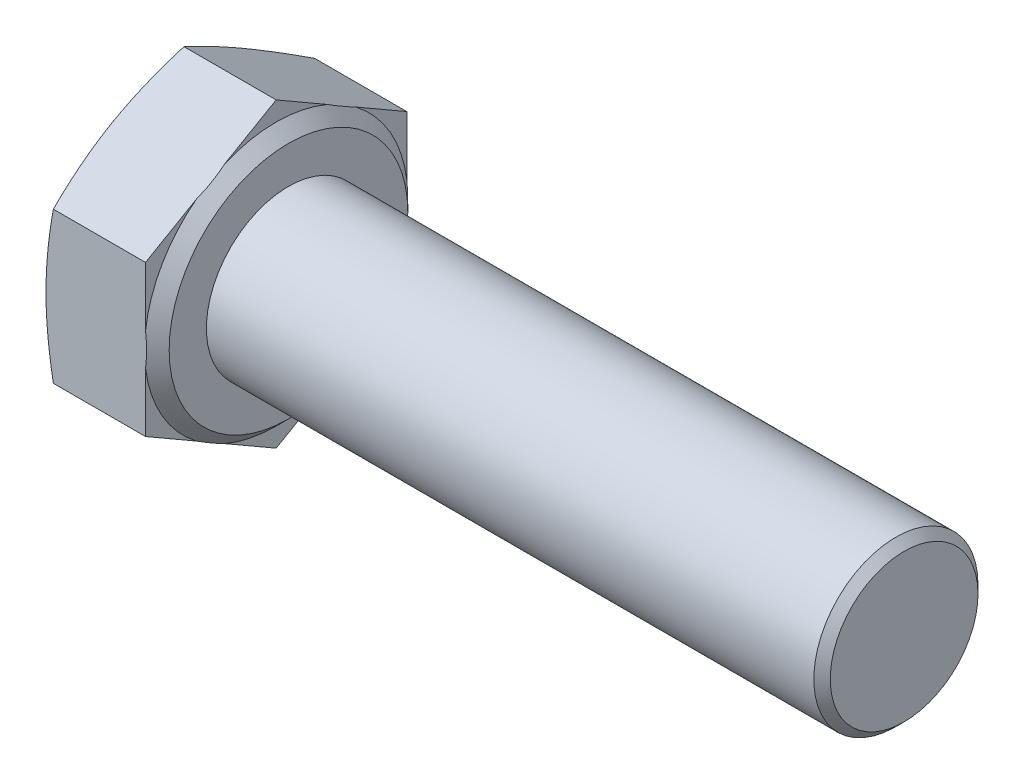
SolidWorks part; units mm, degrees
ref_plane "Front" through (0, 0, 0) normal (0, 0, 1) x (1, 0, 0)
ref_plane "Top" through (0, 0, 0) normal (0, 1, 0) x (1, 0, 0)
ref_plane "Right" through (0, 0, 0) normal (1, 0, 0) x (0, 0, -1)
sketch "Sketch2" plane through (0, 0, 0) normal (1, 0, 0) x (0, 0, -1)
  line L1 (6.365, -3.6748) -> (6.365, 3.6748)
  line L2 (6.365, 3.6748) -> (0, 7.3497)
  line L3 (0, 7.3497) -> (-6.365, 3.6748)
  line L4 (-6.365, 3.6748) -> (-6.365, -3.6748)
  line L5 (-6.365, -3.6748) -> (0, -7.3497)
  line L6 (0, -7.3497) -> (6.365, -3.6748)
  circle A0 centre (0, 0) radius 6.365 construction
  dimension "s" = 12.73
extrude "BaseHead" add sketch "Sketch2" along normal blind 5.45
sketch "Sketch3" plane through (0, 0, 0) normal (0, 0, 1) x (1, 0, 0)
  line L0 (5.45, 7.3497) -> (5.45, 5.815)
  line L2 (5.45, 5.815) -> (4.85, 6.415)
  line L3 (4.85, 6.415) -> (4.85, 7.3497)
  line L5 (4.85, 7.3497) -> (5.45, 7.3497)
  line L6 (-0.9571, 0) -> (7.6478, 0) construction
  line L7 (5.45, 7.3497) -> (0, 7.3497) construction
  dimension "D1" = 45
  dimension "c" = 0.6
  dimension "Dw" = 5.815
revolve "BearingFace" cut sketch "Sketch3" angle 360 about L6
sketch "Sketch4" plane through (0, 0, 0) normal (0, 0, 1) x (1, 0, 0)
  line L0 (-0.4935, 0) -> (3.5626, 0) construction
  line L2 (0, 7.3497) -> (0.3584, 7.3497)
  line L4 (0.3584, 7.3497) -> (0, 6.365)
  line L6 (0, 6.365) -> (0, 7.3497)
  line L7 (4.85, 7.3497) -> (0, 7.3497) construction
  dimension "D1" = 20
  dimension "D2" = 12.73
revolve "HeadChamfer" cut sketch "Sketch4" angle 360 about L0
sketch "Sketch5" plane through (5.45, 0, 0) normal (1, 0, 0) x (0, 0, -1)
  circle A0 centre (0, 0) radius 4
  dimension "d" = 8
extrude "BaseBody" add sketch "Sketch5" along normal blind 30
chamfer "Chamfer1" distance 0.4 angle 45 1 edges at (35.45, 0, -4)
fillet "HeadFillet" [suppressed] radius 0.4
sketch "Sketch6" plane through (0, 0, 0) normal (0, 0, 1) x (1, 0, 0)
  line L0 (5.45, 4.6765) -> (6.1265, 4.6765)
  line L1 (6.1265, 4.6765) -> (6.1265, 4)
  line L2 (6.1265, 4) -> (5.7882, 3.4141)
  line L3 (5.7882, 3.4141) -> (5.45, 4)
  line L4 (5.45, 4) -> (5.45, 4.6765)
  line L5 (35.05, 4) -> (5.45, 4) construction
  line L6 (5.45, -5.815) -> (5.45, 5.815) construction
  dimension "D1" = 0.6765
revolve "Cut-Revolve10" [suppressed] cut sketch "Sketch6" angle 360 about axis through (-0.9571, 0, 0) along (1, 0, 0)
pattern_linear "LPattern10" [suppressed] count 37
equation "\"D2@Sketch4\" = \"s@Sketch2\""
equation "\"D1@Chamfer1\" = 0.05 * \"d@Sketch5\""
equation "\"D1@Sketch6\" =  ( \"d@Sketch5\" - \"D2@ThreadCosmetic1\" )  / 2"
equation "\"pitch@LPattern10\" = \"D1@Sketch6\" * 1.2"
equation "\"D1@LPattern10\" = \"l@BaseBody\" / \"pitch@LPattern10\""
